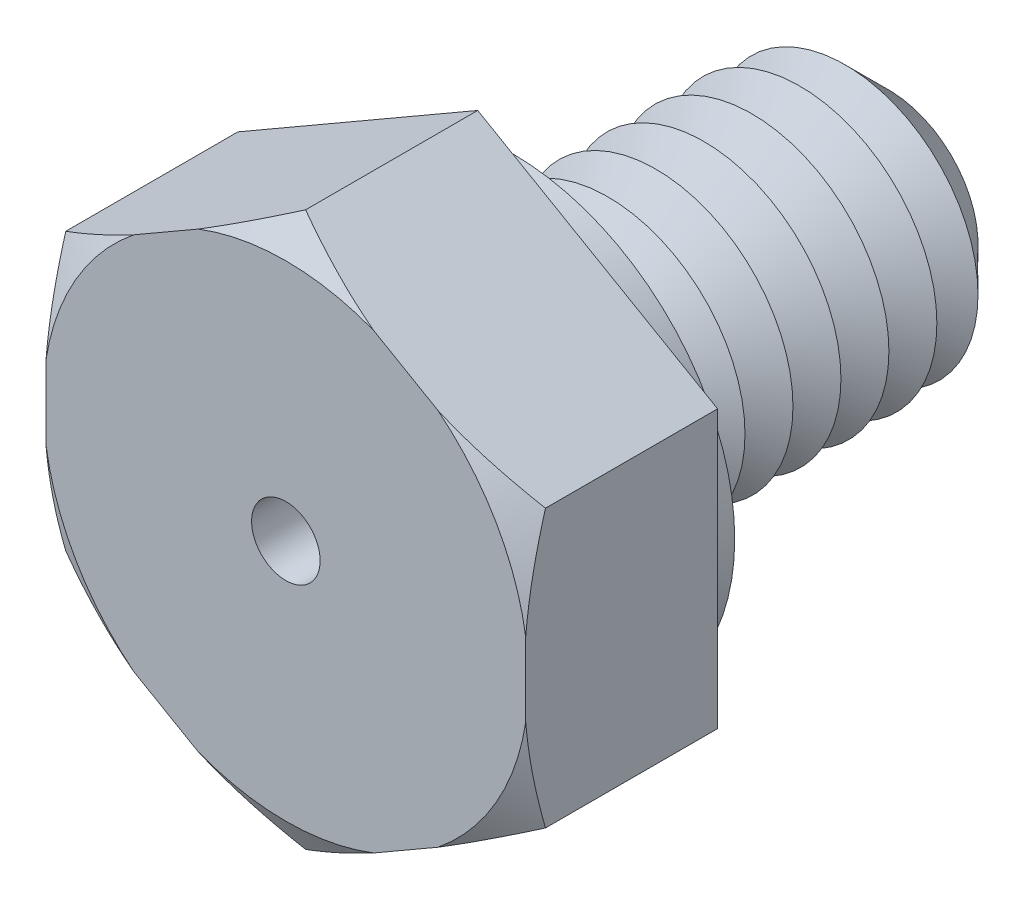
SolidWorks part; units mm, degrees
ref_plane "Front Plane" through (0, 0, 0) normal (0, 0, 1) x (1, 0, 0)
ref_plane "Top Plane" through (0, 0, 0) normal (0, 1, 0) x (1, 0, 0)
ref_plane "Right Plane" through (0, 0, 0) normal (1, 0, 0) x (0, 0, -1)
sketch "Sketch2" plane through (0, 0, 0) normal (0, 0, 1) x (1, 0, 0)
  line L1 (0, 4.0415) -> (-3.5, 2.0207)
  line L2 (-3.5, 2.0207) -> (-3.5, -2.0207)
  line L3 (-3.5, -2.0207) -> (0, -4.0415)
  line L4 (0, -4.0415) -> (3.5, -2.0207)
  line L5 (3.5, -2.0207) -> (3.5, 2.0207)
  line L6 (3.5, 2.0207) -> (0, 4.0415)
  circle A0 centre (0, 0) radius 3.5 construction
  dimension "D1" = 7
extrude "Boss-Extrude1" add sketch "Sketch2" along normal blind 2.8
sketch "Sketch3" plane through (0, 0, 0) normal (0, 0, -1) x (-1, 0, 0)
  circle A0 centre (0, 0) radius 2
  dimension "D1" = 4
extrude "Boss-Extrude2" add sketch "Sketch3" along normal blind 6
sketch "Sketch4" plane through (0, 0, 0) normal (0, 0, -1) x (-1, 0, 0)
  circle A0 centre (0, 0) radius 3.25
  dimension "D1" = 6.5
extrude "Boss-Extrude3" add sketch "Sketch4" along normal blind 0.5
sketch "Sketch5" plane through (0, 0, 0) normal (1, 0, 0) x (0, 0, -1)
  line L0 (-3.2117, 0) -> (6.3192, 0) construction
chamfer "Chamfer1" distance 0.7 angle 45 1 edges at (-2, 0, -6)
sketch "Sketch6" plane through (0, 0, 0) normal (1, 0, 0) x (0, 0, -1)
  line L0 (0.5, 2) -> (0.85, 1.3938)
  line L1 (0.85, 1.3938) -> (1.2, 2)
  line L2 (5.3, 2) -> (0.5, 2) construction
  line L3 (1.2, 2) -> (0.5, 2)
  dimension "D1" = 0.7
revolve "Cut-Revolve1" cut sketch "Sketch6" angle 360 about L0
pattern_linear "LPattern1" count 7 spacing 0.7 along (0, 0, -1) of "Cut-Revolve1"
sketch "Sketch7" plane through (0, 0, 0) normal (1, 0, 0) x (0, 0, -1)
  line L0 (-2.8, 4.0415) -> (-2.8, 3.5415)
  line L1 (-2.8, 2.0207) -> (-2.8, 4.0415) construction
  line L2 (-2.8, 3.5415) -> (-2.5113, 4.0415)
  line L3 (-2.8, 4.0415) -> (0, 4.0415) construction
  line L4 (-2.5113, 4.0415) -> (-2.8, 4.0415)
  dimension "D1" = 0.5
  dimension "D2" = 30
revolve "Cut-Revolve2" cut sketch "Sketch7" angle 360 about L0
sketch "Sketch8" plane through (0, 0, 2.8) normal (0, 0, 1) x (1, 0, 0)
  circle A0 centre (0, 0) radius 0.5
  dimension "D1" = 1
extrude "Cut-Extrude1" cut sketch "Sketch8" against normal up to surface (8.8 mm away)
